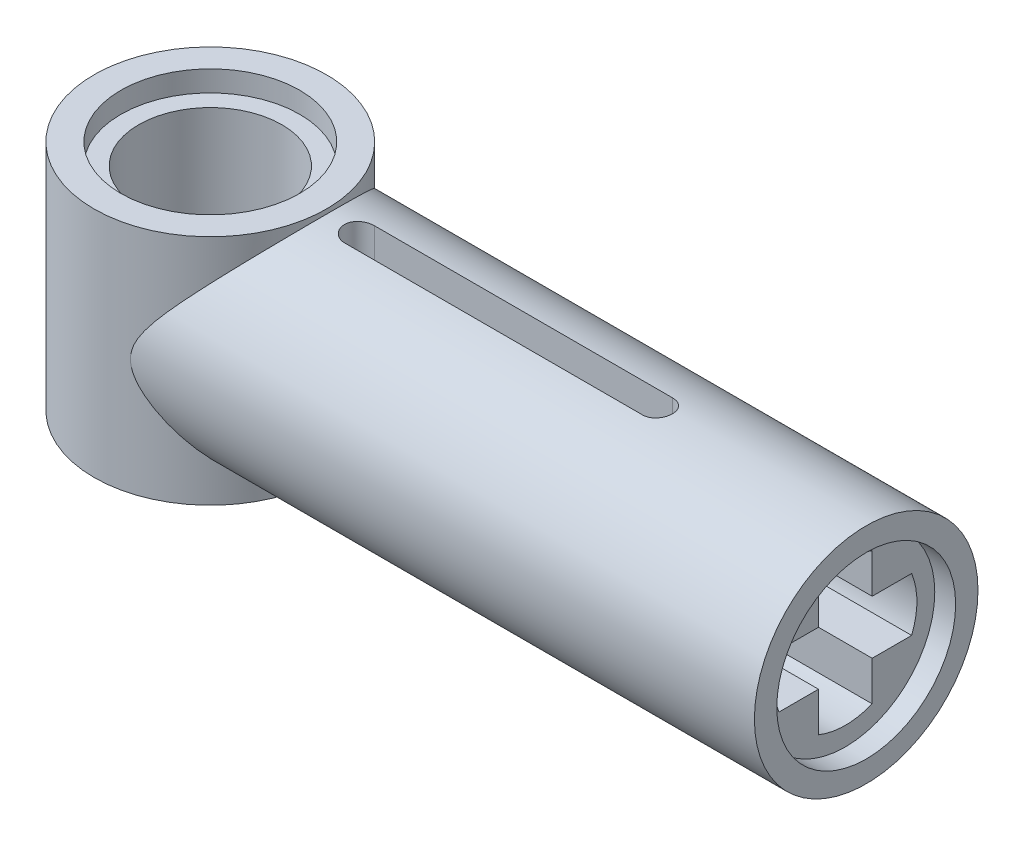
SolidWorks part; units mm, degrees
ref_plane "Front Plane" through (0, 0, 0) normal (0, 0, 1) x (1, 0, 0)
ref_plane "Top Plane" through (0, 0, 0) normal (0, 1, 0) x (1, 0, 0)
ref_plane "Right Plane" through (0, 0, 0) normal (1, 0, 0) x (0, 0, -1)
sketch "Sketch1" plane through (0, 0, 0) normal (0, 1, 0) x (1, 0, 0)
  circle A0 centre (0, 0) radius 3.9
  dimension "D1" = 7.8
extrude "Boss-Extrude1" add sketch "Sketch1" along normal blind 7.8
sketch "Sketch2" plane through (0, 7.8, 0) normal (0, 1, 0) x (1, 0, 0)
  circle A0 centre (0, 0) radius 3
  dimension "D1" = 6
extrude "Cut-Extrude1" cut sketch "Sketch2" against normal blind 0.7
sketch "Sketch3" plane through (0, 0, 0) normal (0, -1, 0) x (1, 0, 0)
  circle A0 centre (0, 0) radius 3
  dimension "D1" = 6
extrude "Cut-Extrude2" cut sketch "Sketch3" against normal blind 0.7
sketch "Sketch4" plane through (0, 0, 0) normal (0, -1, 0) x (1, 0, 0)
  circle A0 centre (0, 0) radius 2.4
  dimension "D1" = 4.8
extrude "Cut-Extrude3" cut sketch "Sketch4" against normal through all
ref_plane "Plane1" through (22, 0, 0) normal (1, 0, 0) x (0, 0, -1)
sketch "Sketch6" plane through (22, 0, 0) normal (1, 0, 0) x (0, 0, -1)
  line L0 (-3.9, 0) -> (3.9, 0) construction
  circle A0 centre (0, 3.9) radius 3.75
  dimension "D1" = 7.5
  dimension "D2" = 3.9
extrude "Boss-Extrude2" add sketch "Sketch6" against normal up to surface (20.9288 mm away)
sketch "Sketch7" plane through (22, 0, 0) normal (1, 0, 0) x (0, 0, -1)
  line L0 (0, 7.65) -> (0, 0.15) construction
  line L1 (-3.75, 3.9) -> (4.6007, 3.9) construction
  line L2 (-2.2249, 4.8) -> (-0.9, 4.8)
  line L3 (-2.2249, 3) -> (-0.9, 3)
  line L4 (-0.9, 6.1249) -> (-0.9, 4.8)
  line L5 (0.9, 6.1249) -> (0.9, 4.8)
  line L6 (-0.9, 3) -> (-0.9, 1.6751)
  line L7 (0.9, 3) -> (0.9, 1.6751)
  line L8 (0.9, 4.8) -> (2.2249, 4.8)
  line L9 (0.9, 3) -> (2.2249, 3)
  circle A0 centre (0, 3.9) radius 3.75 construction
  circle A1 centre (0, 3.9) radius 3.75 construction
  arc A2 (-2.2249, 4.8) -> (-2.2249, 3) centre (0, 3.9) ccw
  arc A3 (0.9, 6.1249) -> (-0.9, 6.1249) centre (0, 3.9) ccw
  arc A4 (2.2249, 3) -> (2.2249, 4.8) centre (0, 3.9) ccw
  arc A5 (-0.9, 1.6751) -> (0.9, 1.6751) centre (0, 3.9) ccw
  dimension "D5" = 4.8
  dimension "D1" = 0.9
  dimension "D2" = 1.8
  dimension "D3" = 0.9
  dimension "D4" = 1.8
extrude "Cut-Extrude4" cut sketch "Sketch7" against normal blind 19
sketch "Sketch8" plane through (22, 0, 0) normal (1, 0, 0) x (0, 0, -1)
  circle A0 centre (0, 3.8714) radius 3
  dimension "D1" = 6
extrude "Cut-Extrude5" cut sketch "Sketch8" against normal blind 0.7
sketch "Sketch9" plane through (0, 0, 0) normal (0, 1, 0) x (1, 0, 0)
  line L0 (0, 0) -> (27.2656, 0) construction
  line L1 (5, 0) -> (15, 0) construction
  line L2 (5, 0.5) -> (15, 0.5)
  line L3 (5, -0.5) -> (15, -0.5)
  line L4 (22, -4.29) -> (22, 4.29) construction
  arc A0 (5, 0.5) -> (5, -0.5) centre (5, 0) ccw
  arc A1 (15, -0.5) -> (15, 0.5) centre (15, 0) ccw
  point P5 (10, 0)
  dimension "D1" = 17
  dimension "D2" = 10
  dimension "D3" = 1
extrude "Cut-Extrude6" cut sketch "Sketch9" along normal blind 8.7
